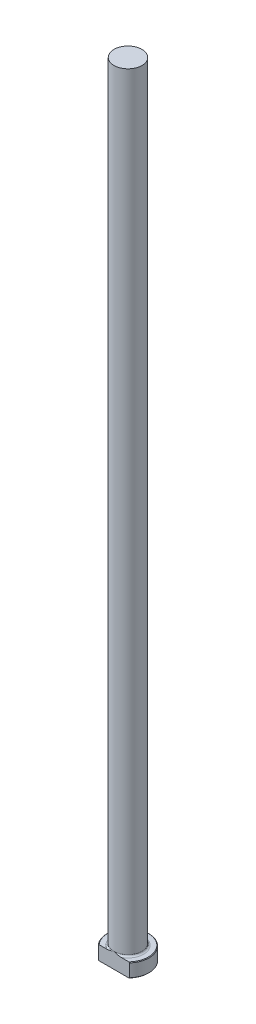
SolidWorks part; units mm, degrees
ref_plane "Front Plane" through (0, 0, 0) normal (0, 0, 1) x (1, 0, 0)
ref_plane "Top Plane" through (0, 0, 0) normal (0, 1, 0) x (1, 0, 0)
ref_plane "Right Plane" through (0, 0, 0) normal (1, 0, 0) x (0, 0, -1)
sketch "Sketch1" plane through (0, 0, 0) normal (0, 0, 1) x (1, 0, 0)
  line L0 (0, 259.9588) -> (0, -15.1925) construction
  line L1 (0, 0) -> (-9.525, 0)
  line L2 (-9.525, 0) -> (-9.525, 6.35)
  line L3 (-9.525, 6.35) -> (-6.35, 6.35)
  line L4 (-6.35, 6.35) -> (-6.35, 355.6)
  line L5 (-6.35, 355.6) -> (0, 355.6)
  line L6 (0, 355.6) -> (0, 0)
  dimension "L" = 355.6
  dimension "H" = 19.05
  dimension "T" = 6.35
  dimension "D" = 12.7
revolve "Revolve1" add sketch "Sketch1" angle 360 about L0
chamfer "Chamfer1" distance 0.254 angle 45 2 edges at (0, 6.35, 9.525) (0, 0, 9.525)
fillet "Fillet1" radius 0.762 1 edges at (0, 6.35, 6.35)
sketch "Sketch2" plane through (0, 0, 0) normal (0, -1, 0) x (1, 0, 0)
  line L0 (-7.0995, 6.35) -> (7.0995, 6.35)
  arc A0 (7.0995, 6.35) -> (-7.0995, 6.35) centre (0, 0) ccw
  circle A1 centre (0, 0) radius 9.525 construction
  circle A3 centre (0, 0) radius 6.35 construction
extrude "KEY" cut sketch "Sketch2" against normal through all
sketch "Pocket Sketch" plane through (0, 0, 0) normal (0, 0, 1) x (1, 0, 0)
  line L0 (-9.9219, 0) -> (-9.9219, 6.3754)
  line L1 (-9.9219, 6.3754) -> (-7.5089, 6.3754)
  line L2 (-6.7469, 7.1374) -> (-6.7469, 22.225)
  line L3 (-6.7469, 22.225) -> (0, 22.225)
  line L4 (0, 22.225) -> (0, 0)
  line L5 (0, 0) -> (-9.9219, 0)
  line L6 (0, 12.6104) -> (0, -2.4989) construction
  line L7 (-9.525, 6.096) -> (-9.525, 0.254) construction
  line L8 (9.271, 6.35) -> (-9.271, 6.35) construction
  line L9 (-6.35, 355.6) -> (-6.35, 7.112) construction
  line L10 (-7.5089, 6.3754) -> (-6.7469, 7.1374)
  point P3 (-6.7469, 6.3754)
  dimension "D1" = 19.8437
  dimension "D2" = 0.3969
  dimension "D3" = 0.0254
  dimension "D4" = 0.3969
  dimension "D5" = 13.4937
  dimension "D6" = 22.225
